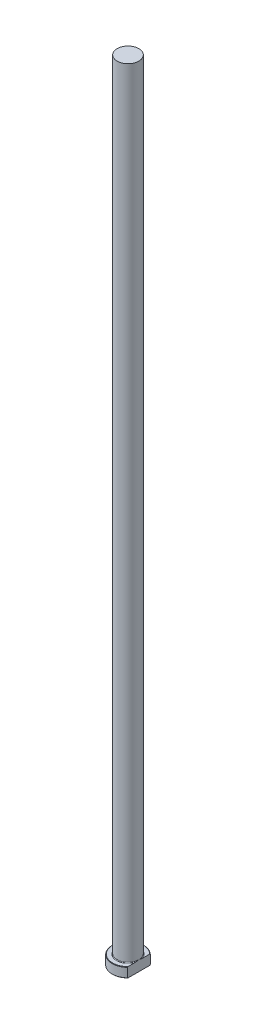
SolidWorks part; units mm, degrees
ref_plane "Front Plane" through (0, 0, 0) normal (0, 0, 1) x (1, 0, 0)
ref_plane "Top Plane" through (0, 0, 0) normal (0, 1, 0) x (1, 0, 0)
ref_plane "Right Plane" through (0, 0, 0) normal (1, 0, 0) x (0, 0, -1)
sketch "Sketch1" plane through (0, 0, 0) normal (0, 0, 1) x (1, 0, 0)
  line L0 (0, 259.9588) -> (0, -15.1925) construction
  line L1 (0, 0) -> (-8, 0)
  line L2 (-8, 0) -> (-8, 5)
  line L3 (-8, 5) -> (-5.5, 5)
  line L4 (-5.5, 5) -> (-5.5, 400)
  line L5 (-5.5, 400) -> (0, 400)
  line L6 (0, 400) -> (0, 0)
  dimension "L" = 400
  dimension "H" = 16
  dimension "T" = 5
  dimension "D" = 11
revolve "Revolve1" add sketch "Sketch1" angle 360 about L0
chamfer "Chamfer1" distance 0.2 angle 45 2 edges at (0, 5, 8) (0, 0, 8)
fillet "Fillet1" radius 0.3 1 edges at (0, 5, 5.5)
sketch "Sketch2" plane through (0, 0, 0) normal (0, 1, 0) x (1, 0, 0)
  line L0 (5.5, 5.8095) -> (5.5, -5.8095)
  circle A0 centre (0, 0) radius 8 construction
  arc A1 (5.5, -5.8095) -> (5.5, 5.8095) centre (0, 0) ccw
  circle A2 centre (0, 0) radius 5.5 construction
extrude "KEY" cut sketch "Sketch2" along normal through all
